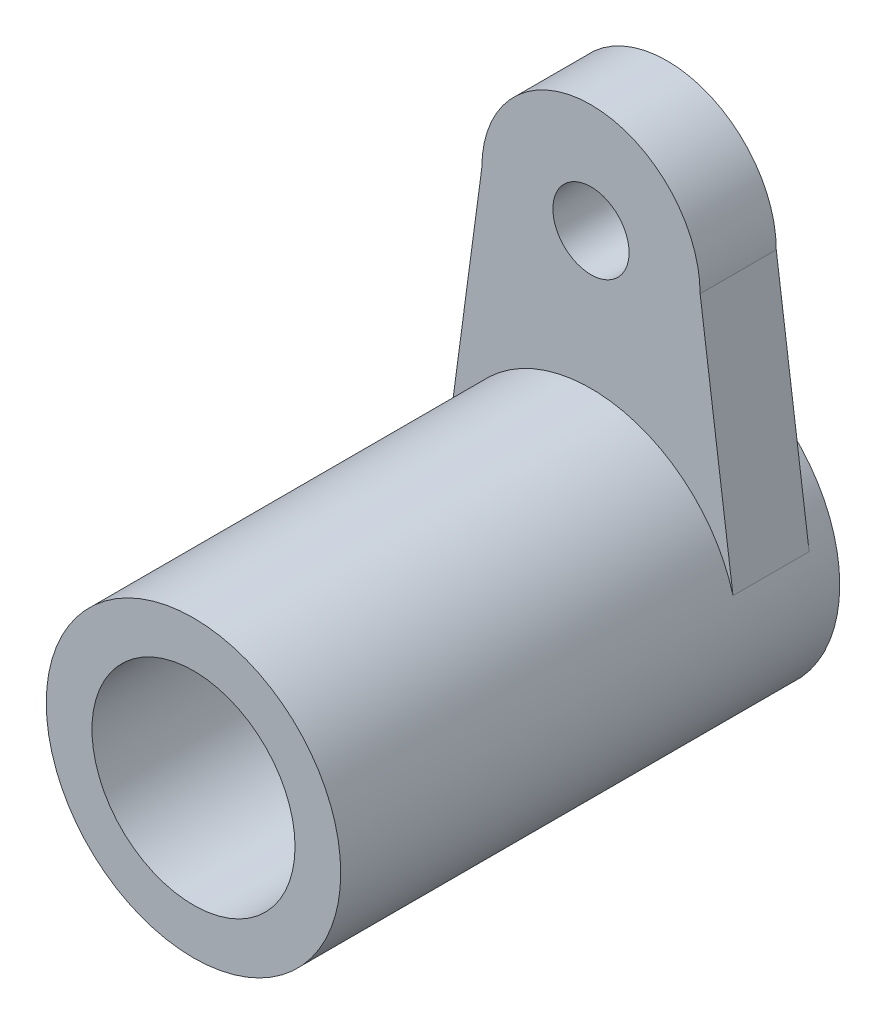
SolidWorks part; units mm, degrees
ref_plane "前视基准面" through (0, 0, 0) normal (0, 0, 1) x (1, 0, 0)
ref_plane "上视基准面" through (0, 0, 0) normal (0, 1, 0) x (1, 0, 0)
ref_plane "右视基准面" through (0, 0, 0) normal (1, 0, 0) x (0, 0, -1)
other "Configuration Table"
sketch "草图1" plane through (0, 0, 0) normal (0, 0, 1) x (1, 0, 0)
  line L1 (-2.15, 0) -> (-2.7974, -4.8256)
  line L2 (2.15, 0) -> (2.7974, -4.8256)
  arc A0 (2.15, 0) -> (-2.15, 0) centre (0, 0) ccw
  arc A1 (-2.7974, -4.8256) -> (2.7974, -4.8256) centre (0, -5.59) ccw
extrude "凸台-拉伸1" add sketch "草图1" along normal blind 1.5
sketch "草图3" plane through (0, 0, 1.5) normal (0, 0, 1) x (1, 0, 0)
  circle A0 centre (0, -5.59) radius 2.9
extrude "凸台-拉伸2" add sketch "草图3" along normal blind 3.829
sketch "草图4" plane through (0, 0, 0) normal (0, 0, -1) x (-1, 0, 0)
  circle A0 centre (0, -5.59) radius 2.9
extrude "凸台-拉伸3" add sketch "草图4" along normal blind 0.5
sketch "草图5" plane through (0, 0, 5.329) normal (0, 0, 1) x (1, 0, 0)
  circle A0 centre (0, -5.59) radius 2
extrude "切除-拉伸1" cut sketch "草图5" against normal blind 3
sketch "草图6" plane through (0, 0, -0.5) normal (0, 0, -1) x (-1, 0, 0)
  circle A0 centre (0, -5.59) radius 2
extrude "切除-拉伸2" cut sketch "草图6" against normal blind 0.7
sketch "草图7" plane through (0, 0, 0.2) normal (0, 0, -1) x (-1, 0, 0)
  circle A0 centre (0, -5.59) radius 1.1
extrude "切除-拉伸3" cut sketch "草图7" against normal blind 3.7
sketch "草图8" plane through (0, 0, 1.5) normal (0, 0, 1) x (1, 0, 0)
  circle A0 centre (0, 0) radius 0.75
extrude "切除-拉伸4" cut sketch "草图8" against normal blind 3.7
sketch "草图9" plane through (0, 0, 0) normal (0, 0, -1) x (-1, 0, 0)
  circle A0 centre (0, 0) radius 1.1476
sketch "草图10" plane through (0, 0, 5.329) normal (0, 0, 1) x (1, 0, 0)
  circle A0 centre (0, -5.59) radius 2
  circle A1 centre (0, -5.59) radius 2.9
  circle A2 centre (0, -5.59) radius 2.9
  dimension "D1" = 0
extrude "凸台-拉伸4" add sketch "草图10" along normal blind 4
